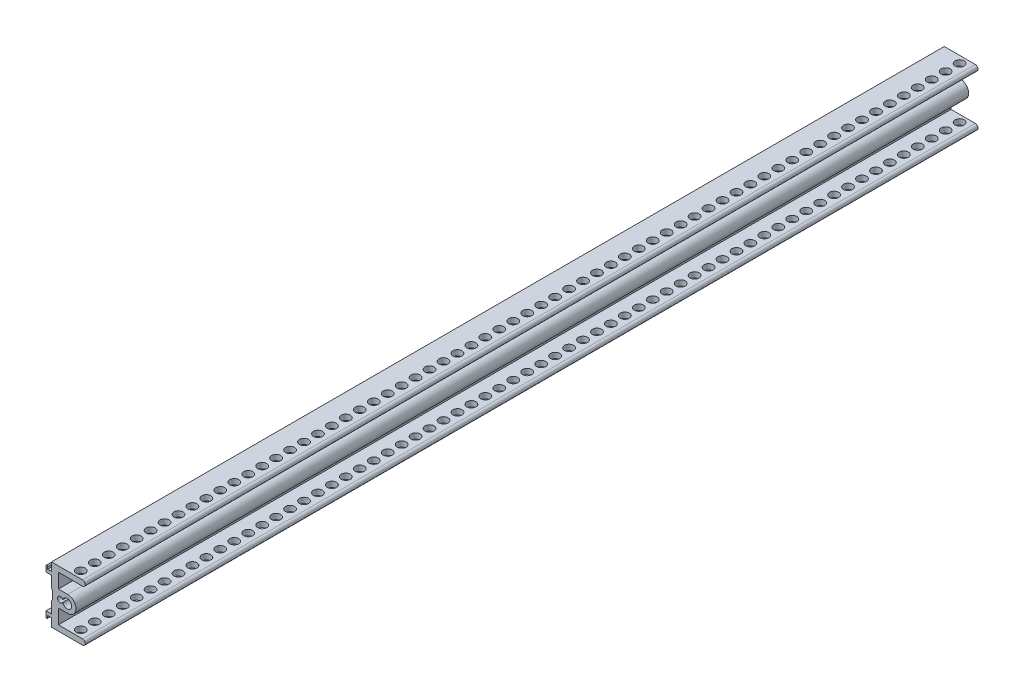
SolidWorks part; units mm, degrees
ref_plane "前视基准面" through (0, 0, 0) normal (0, 0, 1) x (1, 0, 0)
ref_plane "上视基准面" through (0, 0, 0) normal (0, 1, 0) x (1, 0, 0)
ref_plane "右视基准面" through (0, 0, 0) normal (1, 0, 0) x (0, 0, -1)
sketch "草图1" plane through (0, 0, 0) normal (0, 0, 1) x (1, 0, 0)
  line L0 (-4.15, 8.3) -> (-4.15, 3)
  line L1 (-6.65, 10.3) -> (4.65, 10.3)
  line L2 (-6.65, 7.3) -> (-8.05, 7.3)
  line L3 (4.65, 8.3) -> (-4.15, 8.3)
  line L4 (-6.65, -6.1) -> (-6.65, -2.0884)
  line L5 (-6.65, 2.1116) -> (-6.35, 1.5116)
  line L6 (-0.75, 0) -> (3.3598, 0) construction
  line L7 (-6.65, -7.3) -> (-6.65, -10.3)
  line L8 (-8.65, -8.0782) -> (-8.65, -6.1)
  line L9 (-6.65, -6.1) -> (-8.65, -6.1)
  line L10 (-8.05, -8.0782) -> (-8.05, -7.3)
  line L11 (-6.65, -2.0884) -> (-6.35, -1.4884)
  line L12 (-6.65, 2.1116) -> (-6.65, 6.1)
  line L13 (4.65, -8.3) -> (-4.15, -8.3)
  line L14 (-6.65, -10.3) -> (4.65, -10.3)
  line L15 (-4.15, -8.3) -> (-4.15, -3)
  line L16 (-6.35, 1.5116) -> (-6.35, -1.4884)
  line L17 (-4.15, 3) -> (-0.75, 3)
  line L18 (-8.05, 8.0782) -> (-8.05, 7.3)
  line L19 (-0.75, -3) -> (-4.15, -3)
  line L20 (-6.65, 6.1) -> (-8.65, 6.1)
  line L21 (-8.65, 8.0782) -> (-8.65, 6.1)
  line L22 (-6.65, -7.3) -> (-8.05, -7.3)
  line L23 (-8.35, -8.3782) -> (-9.7583, -8.3782) construction
  line L24 (-8.35, 8.3782) -> (-9.5309, 8.3782) construction
  line L25 (-6.65, 7.3) -> (-6.65, 10.3)
  arc A0 (-8.65, 8.0782) -> (-8.05, 8.0782) centre (-8.35, 8.0782) cw
  arc A4 (4.65, -8.3) -> (4.65, -10.3) centre (4.65, -9.3) cw
  arc A6 (-8.65, -8.0782) -> (-8.05, -8.0782) centre (-8.35, -8.0782) ccw
  arc A8 (4.65, 8.3) -> (4.65, 10.3) centre (4.65, 9.3) ccw
  arc A10 (-0.75, 3) -> (-0.75, -3) centre (-0.75, 0) cw
  arc A11 (-2.5445, -0.4243) -> (-2.5445, 0.4243) centre (-0.95, 0) ccw
  arc A12 (-2.5445, 0.4243) -> (-2.5445, -0.4243) centre (-3.45, 0) ccw
  dimension "D4" = 1.4
  dimension "D12" = 16.7565
  dimension "D3" = 0.3
  dimension "D8" = 7.7
  dimension "D5" = 2
  dimension "D6" = 0.3
  dimension "D7" = 2
  dimension "D11" = 1
  dimension "D1" = 1.2
  dimension "D2" = 3
  dimension "D9" = 13.3
  dimension "D10" = 13.3
extrude "凸台-拉伸1" add sketch "草图1" along normal mid plane 325.12
sketch "草图3" plane through (0, -10.3, 0) normal (0, -1, 0) x (1, 0, 0)
  line L0 (-6.65, 162.56) -> (4.65, 162.56) construction
  line L2 (4.65, 162.56) -> (4.65, -162.56) construction
  circle A0 centre (1.5, 160.02) radius 1.65
  circle A1 centre (1.5, 154.94) radius 1.65
  circle A2 centre (1.5, 149.86) radius 1.65
  circle A3 centre (1.5, 144.78) radius 1.65
  circle A4 centre (1.5, 139.7) radius 1.65
  circle A5 centre (1.5, 134.62) radius 1.65
  circle A6 centre (1.5, 129.54) radius 1.65
  circle A7 centre (1.5, 124.46) radius 1.65
  circle A8 centre (1.5, 119.38) radius 1.65
  circle A9 centre (1.5, 114.3) radius 1.65
  circle A10 centre (1.5, 109.22) radius 1.65
  circle A11 centre (1.5, 104.14) radius 1.65
  circle A12 centre (1.5, 99.06) radius 1.65
  circle A13 centre (1.5, 93.98) radius 1.65
  circle A14 centre (1.5, 88.9) radius 1.65
  circle A15 centre (1.5, 83.82) radius 1.65
  circle A16 centre (1.5, 78.74) radius 1.65
  circle A17 centre (1.5, 73.66) radius 1.65
  circle A18 centre (1.5, 68.58) radius 1.65
  circle A19 centre (1.5, 63.5) radius 1.65
  circle A20 centre (1.5, 58.42) radius 1.65
  circle A21 centre (1.5, 53.34) radius 1.65
  circle A22 centre (1.5, 48.26) radius 1.65
  circle A23 centre (1.5, 43.18) radius 1.65
  circle A24 centre (1.5, 38.1) radius 1.65
  circle A25 centre (1.5, 33.02) radius 1.65
  circle A26 centre (1.5, 27.94) radius 1.65
  circle A27 centre (1.5, 22.86) radius 1.65
  circle A28 centre (1.5, 17.78) radius 1.65
  circle A29 centre (1.5, 12.7) radius 1.65
  circle A30 centre (1.5, 7.62) radius 1.65
  circle A31 centre (1.5, 2.54) radius 1.65
  circle A32 centre (1.5, -2.54) radius 1.65
  circle A33 centre (1.5, -7.62) radius 1.65
  circle A34 centre (1.5, -12.7) radius 1.65
  circle A35 centre (1.5, -17.78) radius 1.65
  circle A36 centre (1.5, -22.86) radius 1.65
  circle A37 centre (1.5, -27.94) radius 1.65
  circle A38 centre (1.5, -33.02) radius 1.65
  circle A39 centre (1.5, -38.1) radius 1.65
  circle A40 centre (1.5, -43.18) radius 1.65
  circle A41 centre (1.5, -48.26) radius 1.65
  circle A42 centre (1.5, -53.34) radius 1.65
  circle A43 centre (1.5, -58.42) radius 1.65
  circle A44 centre (1.5, -63.5) radius 1.65
  circle A45 centre (1.5, -68.58) radius 1.65
  circle A46 centre (1.5, -73.66) radius 1.65
  circle A47 centre (1.5, -78.74) radius 1.65
  circle A48 centre (1.5, -83.82) radius 1.65
  circle A49 centre (1.5, -88.9) radius 1.65
  circle A50 centre (1.5, -93.98) radius 1.65
  circle A51 centre (1.5, -99.06) radius 1.65
  circle A52 centre (1.5, -104.14) radius 1.65
  circle A53 centre (1.5, -109.22) radius 1.65
  circle A54 centre (1.5, -114.3) radius 1.65
  circle A55 centre (1.5, -119.38) radius 1.65
  circle A56 centre (1.5, -124.46) radius 1.65
  circle A57 centre (1.5, -129.54) radius 1.65
  circle A58 centre (1.5, -134.62) radius 1.65
  circle A59 centre (1.5, -139.7) radius 1.65
  circle A60 centre (1.5, -144.78) radius 1.65
  circle A61 centre (1.5, -149.86) radius 1.65
  circle A62 centre (1.5, -154.94) radius 1.65
  circle A63 centre (1.5, -160.02) radius 1.65
  circle A64 centre (1.5, -165.1) radius 1.65
  circle A65 centre (1.5, -170.18) radius 1.65
  circle A66 centre (1.5, -175.26) radius 1.65
  circle A67 centre (1.5, -180.34) radius 1.65
  circle A68 centre (1.5, -185.42) radius 1.65
  circle A69 centre (1.5, -190.5) radius 1.65
  circle A70 centre (1.5, -195.58) radius 1.65
  circle A71 centre (1.5, -200.66) radius 1.65
  circle A72 centre (1.5, -205.74) radius 1.65
  circle A73 centre (1.5, -210.82) radius 1.65
  circle A74 centre (1.5, -215.9) radius 1.65
  circle A75 centre (1.5, -220.98) radius 1.65
  circle A76 centre (1.5, -226.06) radius 1.65
  circle A77 centre (1.5, -231.14) radius 1.65
  circle A78 centre (1.5, -236.22) radius 1.65
  circle A79 centre (1.5, -241.3) radius 1.65
  circle A80 centre (1.5, -246.38) radius 1.65
  circle A81 centre (1.5, -251.46) radius 1.65
  circle A82 centre (1.5, -256.54) radius 1.65
  circle A83 centre (1.5, -261.62) radius 1.65
  circle A84 centre (1.5, -266.7) radius 1.65
  dimension "D1" = 3.3
  dimension "D2" = 3.15
  dimension "D4" = 85
  dimension "D3" = 2.54
extrude "切除-拉伸1" cut sketch "草图3" against normal blind 2.5
mirror "镜向1" about plane through (0, 0, 0) normal (0, 1, 0) of "切除-拉伸1"
